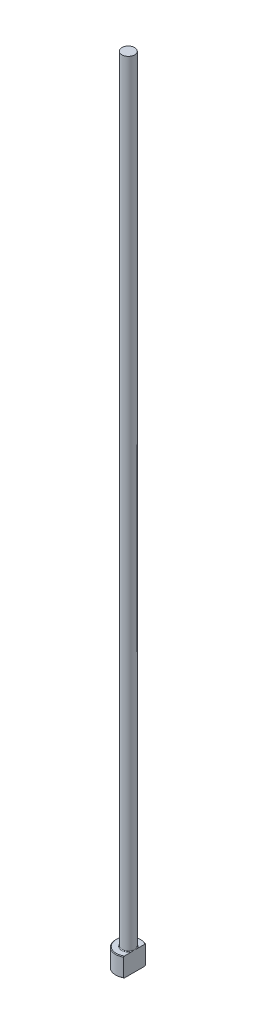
SolidWorks part; units mm, degrees
ref_plane "Front Plane" through (0, 0, 0) normal (0, 0, 1) x (1, 0, 0)
ref_plane "Top Plane" through (0, 0, 0) normal (0, 1, 0) x (1, 0, 0)
ref_plane "Right Plane" through (0, 0, 0) normal (1, 0, 0) x (0, 0, -1)
sketch "Sketch1" plane through (0, 0, 0) normal (0, 0, 1) x (1, 0, 0)
  line L0 (0, 259.9588) -> (0, -15.1925) construction
  line L1 (0, 0) -> (-4, 0)
  line L2 (-4, 0) -> (-4, 6)
  line L3 (-4, 6) -> (-2, 6)
  line L4 (-2, 6) -> (-2, 250)
  line L5 (-2, 250) -> (0, 250)
  line L6 (0, 250) -> (0, 0)
  dimension "L" = 250
  dimension "H" = 8
  dimension "T" = 6
  dimension "D" = 4
revolve "Revolve1" add sketch "Sketch1" angle 360 about L0
chamfer "Chamfer1" distance 0.2 angle 45 2 edges at (0, 6, 4) (0, 0, 4)
fillet "Fillet1" radius 0.2 1 edges at (0, 6, 2)
sketch "Sketch2" plane through (0, 0, 0) normal (0, 1, 0) x (1, 0, 0)
  line L0 (2, -3.4641) -> (2, 3.4641)
  circle A0 centre (0, 0) radius 4 construction
  arc A1 (2, -3.4641) -> (2, 3.4641) centre (0, 0) ccw
  circle A2 centre (0, 0) radius 2 construction
extrude "KEYED HEAD" cut sketch "Sketch2" along normal through all
